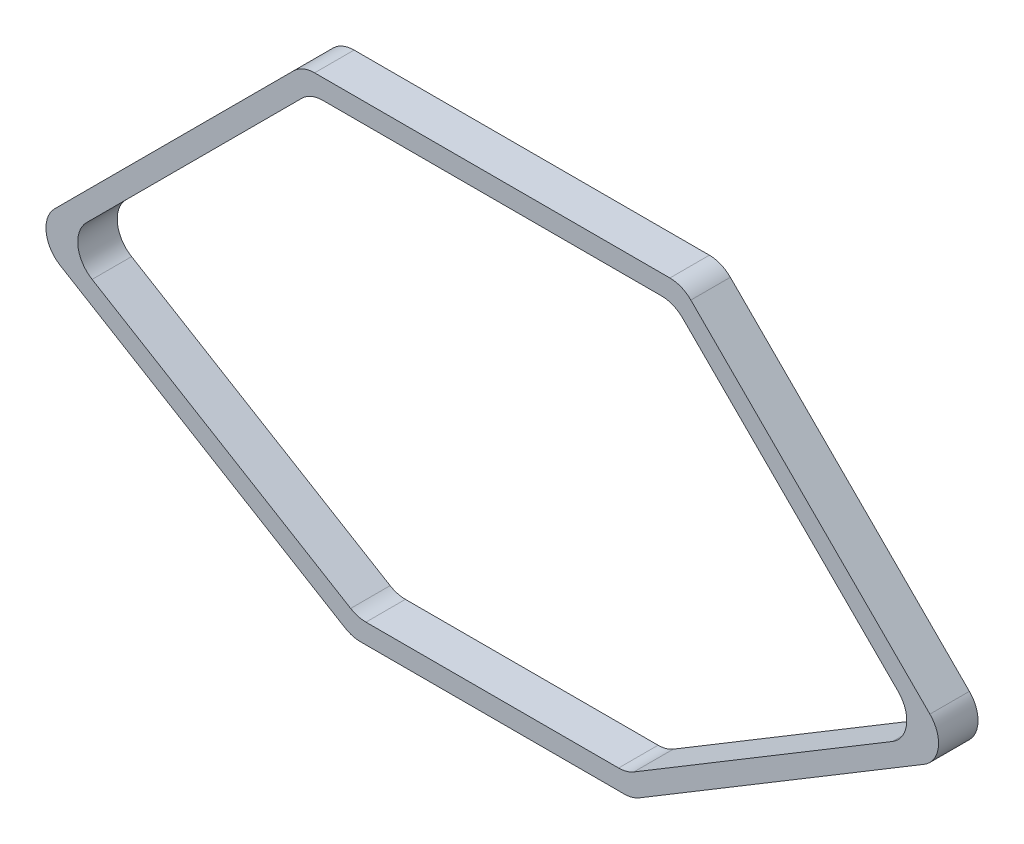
SolidWorks part; units mm, degrees
ref_plane "Front Plane" through (0, 0, 0) normal (0, 0, 1) x (1, 0, 0)
ref_plane "Top Plane" through (0, 0, 0) normal (0, 1, 0) x (1, 0, 0)
ref_plane "Right Plane" through (0, 0, 0) normal (1, 0, 0) x (0, 0, -1)
sketch "ShoulderPositions" plane through (0, 0, 0) normal (0, 0, 1) x (1, 0, 0)
  line L0 (-13.6299, 17.3263) -> (-30.9562, 0) construction
  line L1 (-30.9562, 0) -> (-10.16, -12.5187) construction
  line L2 (-10.16, -12.5187) -> (10.16, -12.5187) construction
  line L3 (10.16, -12.5187) -> (30.9562, 0) construction
  line L4 (30.9562, 0) -> (13.6299, 17.3263) construction
  line L5 (13.6299, 17.3263) -> (-13.6299, 17.3263) construction
  point P0 (-13.6299, 17.3263)
  point P7 (0, 17.3263)
  point P8 (-30.9562, 0)
  point P9 (-10.16, -12.5187)
  point P10 (13.6299, 17.3263)
  point P11 (30.9562, 0)
  point P12 (10.16, -12.5187)
  point P13 (0, -12.5187)
  dimension "D1" = 27.2599
  dimension "D2" = 20.32
  dimension "D3" = 17.3263
  dimension "D4" = 12.5187
  dimension "D5" = 61.9125
sketch "CoilPath" plane through (0, 0, 0) normal (0, 0, 1) x (1, 0, 0)
  line L0 (-36.0725, -0.6261) -> (-14.9451, 20.5013)
  line L1 (-14.9451, 20.5013) -> (14.9451, 20.5013)
  line L2 (14.9451, 20.5013) -> (36.0725, -0.6261)
  line L3 (36.0725, -0.6261) -> (11.0419, -15.6937)
  line L4 (11.0419, -15.6937) -> (-11.0419, -15.6937)
  line L5 (-11.0419, -15.6937) -> (-36.0725, -0.6261)
  line L6 (-13.6299, 17.3263) -> (-30.9562, 0) construction
  line L7 (13.6299, 17.3263) -> (-13.6299, 17.3263) construction
  line L8 (-30.9562, 0) -> (-10.16, -12.5187) construction
  line L9 (-10.16, -12.5187) -> (10.16, -12.5187) construction
  line L10 (10.16, -12.5187) -> (30.9562, 0) construction
  line L11 (30.9562, 0) -> (13.6299, 17.3263) construction
  dimension "D1" = 3.175
  dimension "D2" = 3.175
  dimension "D3" = 3.175
  dimension "D4" = 3.175
  dimension "D5" = 3.175
  dimension "D6" = 3.175
sketch "CoilCrossSection" plane through (0, 0, 0) normal (1, 0, 0) x (0, 0, -1)
  line L0 (-1.5875, 21.2951) -> (-1.5875, 19.7076)
  line L1 (-1.5875, 21.2951) -> (1.5875, 21.2951)
  line L2 (-1.5875, 19.7076) -> (1.5875, 19.7076)
  line L3 (1.5875, 21.2951) -> (1.5875, 19.7076)
  line L4 (-1.5875, 21.2951) -> (1.5875, 19.7076) construction
  line L5 (-1.5875, 19.7076) -> (1.5875, 21.2951) construction
  point P1 (0, 20.5013)
  dimension "D1" = 3.175
  dimension "D2" = 1.5875
sweep "Sweep1" add profiles "CoilCrossSection" path "CoilPath"
fillet "Fillet1" radius 2.3813 12 edges at (-37.3515, -0.7826, 0) (-15.2738, 21.2951, 0) (15.2738, 21.2951, 0) (-11.2624, -16.4874, 0) (11.2624, -16.4874, 0) (37.3515, -0.7826, 0) (-34.7934, -0.4696, 0) (-10.8214, -14.8999, 0) (10.8214, -14.8999, 0) (34.7934, -0.4696, 0) (14.6163, 19.7076, 0) (-14.6163, 19.7076, 0)
